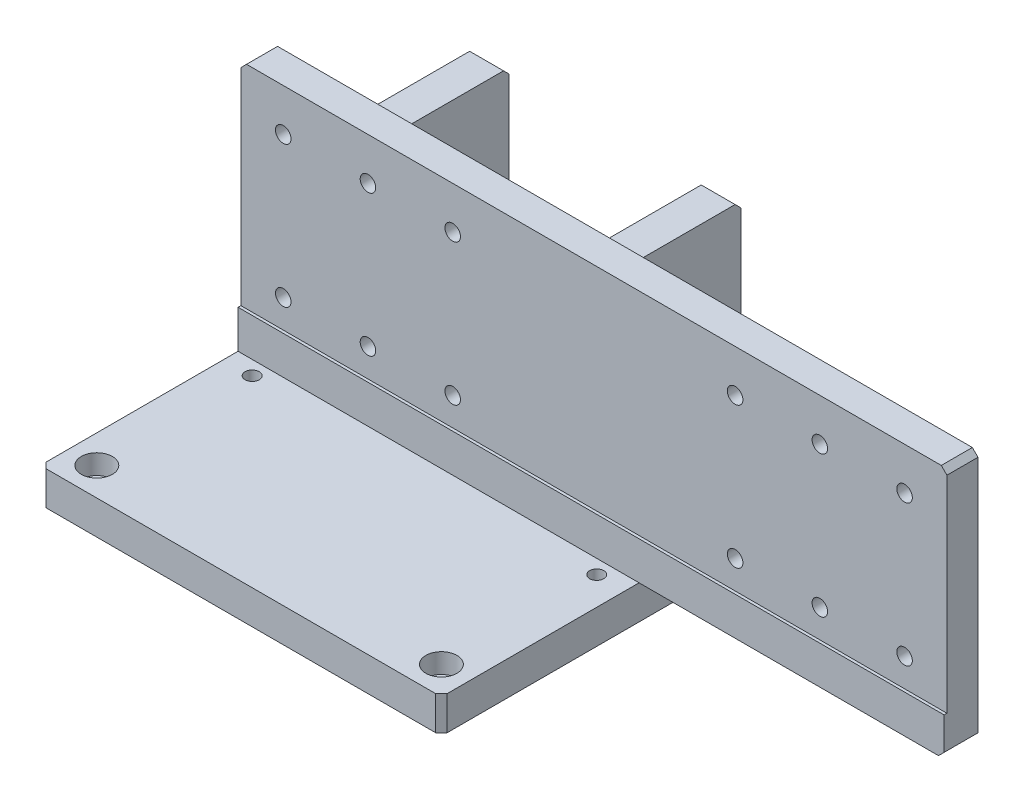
SolidWorks part; units mm, degrees
ref_plane "정면" through (0, 0, 0) normal (0, 0, 1) x (1, 0, 0)
ref_plane "윗면" through (0, 0, 0) normal (0, 1, 0) x (1, 0, 0)
ref_plane "우측면" through (0, 0, 0) normal (1, 0, 0) x (0, 0, -1)
sketch "스케치1" plane through (0, 0, 0) normal (0, 1, 0) x (1, 0, 0)
  line L1 (-71, 65) -> (71, 65)
  line L2 (-71, 65) -> (-71, -65)
  line L3 (-71, -65) -> (71, -65)
  line L4 (71, 65) -> (71, -65)
  line L5 (-71, 65) -> (71, -65) construction
  line L6 (-71, -65) -> (71, 65) construction
  point P0 (0, 0)
  dimension "D1" = 130
  dimension "D2" = 142
extrude "보스-돌출1" add sketch "스케치1" along normal blind 12
sketch "스케치2" plane through (0, 12, 0) normal (0, 1, 0) x (1, 0, 0)
  line L0 (-71, 65) -> (-71, -65) construction
  line L1 (-71, 17) -> (179, 17)
  line L2 (-71, 17) -> (-71, 5)
  line L3 (-71, 5) -> (179, 5)
  line L4 (179, 17) -> (179, 5)
  line L5 (71, 65) -> (-71, 65) construction
  dimension "D1" = 250
  dimension "D2" = 12
  dimension "D3" = 48
extrude "보스-돌출2" add sketch "스케치2" along normal blind 88.5 separate body
sketch "스케치3" plane through (0, 12, 0) normal (0, 1, 0) x (1, 0, 0)
  line L0 (71, 65) -> (-71, 65) construction
  line L1 (-47, 65) -> (-35, 65)
  line L2 (-47, 65) -> (-47, 17)
  line L3 (-47, 17) -> (-35, 17)
  line L4 (-35, 65) -> (-35, 17)
  line L5 (179, 17) -> (-71, 17) construction
  line L6 (-71, 65) -> (-71, -65) construction
  line L7 (35, 65) -> (47, 65)
  line L8 (35, 65) -> (35, 17)
  line L9 (35, 17) -> (47, 17)
  line L10 (47, 65) -> (47, 17)
  dimension "D1" = 24
  dimension "D2" = 12
  dimension "D3" = 70
extrude "보스-돌출3" add sketch "스케치3" along normal blind 75 separate body
sketch "스케치4" plane through (47, 0, 0) normal (1, 0, 0) x (0, 0, -1)
  line L0 (65, 87) -> (63, 87)
  line L1 (17, 87) -> (65, 87) construction
  line L2 (63, 87) -> (65, 85)
  line L3 (65, 87) -> (65, 12) construction
  line L4 (65, 85) -> (65, 87)
  dimension "D1" = 2
  dimension "D2" = 2
extrude "컷-돌출1" cut sketch "스케치4" against normal through all and the other way through all
hole_wizard "M6 소켓 머리 캡 나사용 카운터보어1" positions "스케치5" profile "스케치6" counterbore size "M6" standard "KS"
sketch "스케치5" plane through (0, 12, 0) normal (0, 1, 0) x (1, 0, 0)
  line L0 (-71, 65) -> (-71, -65) construction
  line L1 (-71, -65) -> (71, -65) construction
  point P0 (-61, 55)
  point P2 (61, 55)
  point P4 (-61, -55)
  point P6 (61, -55)
  dimension "D1" = 10
  dimension "D2" = 122
  dimension "D3" = 10
  dimension "D4" = 110
sketch "스케치6" plane through (-61, 12, -55) normal (1, 0, 0) x (0, 0, 1)
  line L0 (0, 0) -> (0, 12)
  line L1 (0, 12) -> (3.3, 12)
  line L3 (3.3, 12) -> (3.3, 7)
  line L4 (3.3, 7) -> (5.5, 7)
  line L5 (5.5, 7) -> (5.5, 0)
  line L7 (5.5, 0) -> (0, 0)
  line L11 (0, -6.35) -> (0, 107.95) construction
  dimension "관통 구멍 지름" = 6.6
  dimension "관통 구멍 깊이" = 12
  dimension "카운터보어 지름" = 11
  dimension "카운터보어 깊이" = 7
hole_wizard "Ø5.0mm 맞춤핀 구멍1" positions "스케치7" profile "스케치8" hole size "Ø5.0" standard "ISO"
sketch "스케치7" plane through (0, 12, 0) normal (0, 1, 0) x (1, 0, 0)
  line L0 (-71, 65) -> (-71, -65) construction
  line L1 (-71, -65) -> (71, -65) construction
  point P0 (-61, 0)
  point P2 (61, 0)
  dimension "D1" = 122
  dimension "D2" = 10
  dimension "D3" = 65
sketch "스케치8" plane through (-61, 12, 0) normal (1, 0, 0) x (0, 0, 1)
  line L0 (0, 0) -> (0, 12)
  line L1 (0, 12) -> (2.5, 12)
  line L2 (2.5, 12) -> (2.5, 0)
  line L5 (2.5, 0) -> (0, 0)
  line L11 (0, -6.35) -> (0, 107.95) construction
  dimension "관통 구멍 지름" = 5
  dimension "관통 구멍 깊이" = 12
hole_wizard "M5 소켓 머리 캡 나사용 카운터보어1" positions "스케치9" profile "스케치10" counterbore size "M5" standard "KS"
sketch "스케치9" plane through (0, 0, -17) normal (0, 0, -1) x (-1, 0, 0)
  line L0 (71, 100.5) -> (71, 12) construction
  line L1 (-179, 100.5) -> (71, 100.5) construction
  point P0 (-4, 85.5)
  point P2 (26, 85.5)
  point P4 (56, 85.5)
  point P6 (-4, 35.5)
  point P8 (26, 35.5)
  point P10 (56, 35.5)
  dimension "D1" = 15
  dimension "D2" = 30
  dimension "D3" = 30
  dimension "D4" = 15
  dimension "D5" = 50
sketch "스케치10" plane through (4, 85.5, -17) normal (1, 0, 0) x (0, 1, 0)
  line L0 (0, 0) -> (0, 12)
  line L1 (0, 12) -> (2.75, 12)
  line L3 (2.75, 12) -> (2.75, 6)
  line L4 (2.75, 6) -> (4.75, 6)
  line L5 (4.75, 6) -> (4.75, 0)
  line L7 (4.75, 0) -> (0, 0)
  line L11 (0, -6.35) -> (0, 107.95) construction
  dimension "관통 구멍 지름" = 5.5
  dimension "관통 구멍 깊이" = 12
  dimension "카운터보어 지름" = 9.5
  dimension "카운터보어 깊이" = 6
hole_wizard "M4 나사 구멍1" positions "스케치11" profile "스케치12" tap size "M4" standard "ISO"
sketch "스케치11" plane through (-71, 0, 0) normal (-1, 0, 0) x (0, 0, 1)
  line L0 (-65, 12) -> (-65, 0) construction
  line L1 (-65, 0) -> (65, 0) construction
  point P0 (-51, 6)
  point P2 (-23, 6)
  dimension "D1" = 28
  dimension "D2" = 14
  dimension "D3" = 6
sketch "스케치12" plane through (-71, 6, -51) normal (0, 1, 0) x (0, 0, 1)
  line L0 (0, 0) -> (0, 4.9914)
  line L1 (0, 4.9914) -> (1.65, 4)
  line L2 (1.65, 4) -> (1.65, 0.375)
  line L3 (1.65, 0.375) -> (2.025, 0)
  line L5 (2.025, 0) -> (0, 0)
  line L6 (-1.65, 0.375) -> (-2.025, 0) construction
  line L10 (0, 4.9914) -> (-1.65, 4) construction
  line L11 (0, -6.35) -> (0, 107.95) construction
  dimension "탭 드릴 지름" = 3.3
  dimension "탭 드릴 깊이" = 4
  dimension "표면 카운터싱크 지름" = 4.05
  dimension "표면 카운터싱크 각도" = 90
  dimension "드릴 각도" = 118
pattern_linear "선형 패턴1" count 2 spacing 160 along (1, 0, 0) of "M5 소켓 머리 캡 나사용 카운터보어1"
sketch "스케치13" plane through (0, 0, -5) normal (0, 0, 1) x (1, 0, 0)
  line L0 (179, 100.5) -> (179, 12) construction
  line L1 (-71, 100.5) -> (179, 100.5)
  line L2 (-71, 100.5) -> (-71, 25.5)
  line L3 (-71, 25.5) -> (179, 25.5)
  line L4 (179, 100.5) -> (179, 25.5)
  line L5 (-71, 0) -> (71, 0) construction
  dimension "D1" = 25.5
extrude "컷-돌출2" cut sketch "스케치13" against normal blind 1
chamfer "모따기3" distance 2 angle 45 3 edges at (179, 100.5, -11.5) (179, 12, -11) (-71, 100.5, -11.5)
chamfer "모따기4" distance 2 angle 45 4 edges at (-71, 6, -65) (71, 6, -65) (71, 6, 65) (-71, 6, 65)
